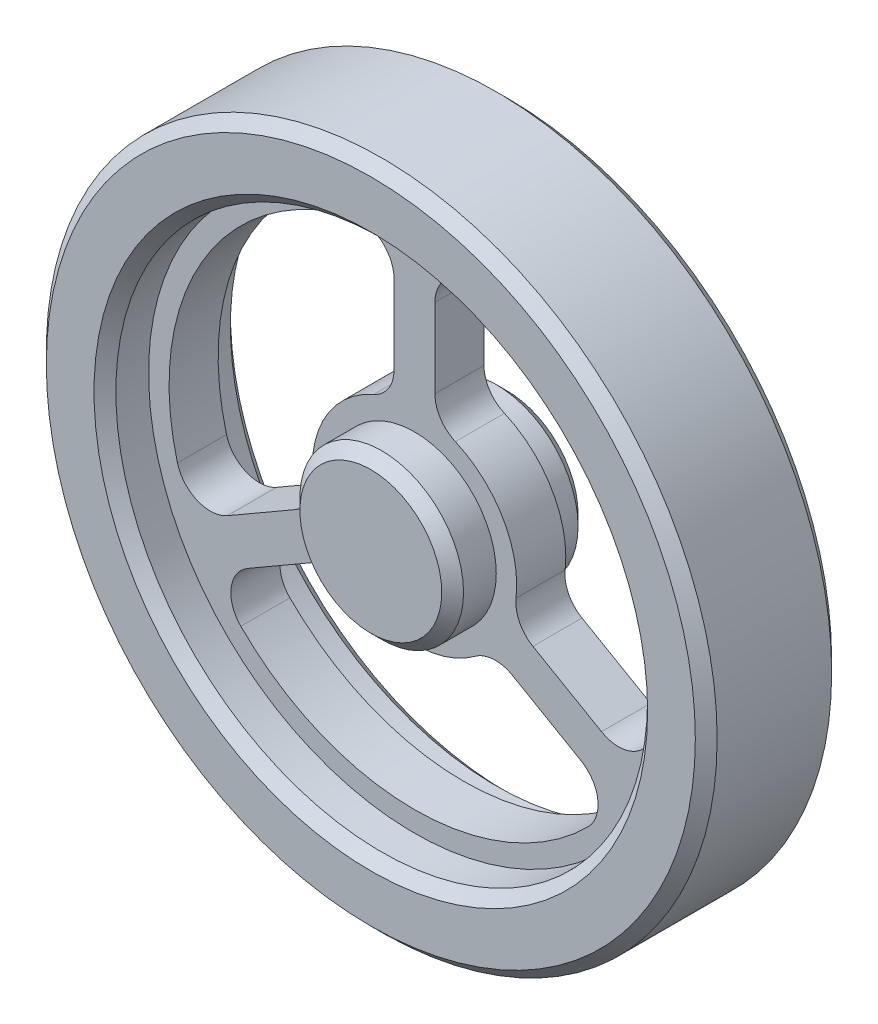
SolidWorks part; units mm, degrees
ref_plane "Front Plane" through (0, 0, 0) normal (0, 0, 1) x (1, 0, 0)
ref_plane "Top Plane" through (0, 0, 0) normal (0, 1, 0) x (1, 0, 0)
ref_plane "Right Plane" through (0, 0, 0) normal (1, 0, 0) x (0, 0, -1)
sketch "Sketch1" plane through (0, 0, 0) normal (0, 0, 1) x (1, 0, 0)
  circle A0 centre (0, 0) radius 24.6
  dimension "D1" = 49.2
extrude "Boss-Extrude1" add sketch "Sketch1" along normal mid plane 10
sketch "Sketch2" plane through (0, 0, 5) normal (0, 0, 1) x (1, 0, 0)
  circle A0 centre (0, 0) radius 6
  circle A1 centre (0, 0) radius 19.5
  dimension "D1" = 12
  dimension "D2" = 39
extrude "Cut-Extrude1" cut sketch "Sketch2" against normal blind 3.2 contours A1 | A0
mirror "Mirror1" about plane through (0, 0, 0) normal (0, 0, 1) of "Cut-Extrude1"
sketch "Sketch5" plane through (0, 0, 5) normal (0, 0, 1) x (1, 0, 0)
  circle A0 centre (0, 0) radius 7.5
  circle A1 centre (0, 0) radius 18
  dimension "D1" = 15
  dimension "D2" = 36
extrude "Cut-Extrude4" cut sketch "Sketch5" against normal through all
sketch "Sketch6" plane through (0, 0, 1.8) normal (0, 0, 1) x (1, 0, 0)
  line L0 (-1.5, 7.3485) -> (-1.5, 17.9374)
  line L1 (1.5, 17.9374) -> (1.5, 7.3485)
  line L2 (0, 0) -> (0, 33.4498) construction
  circle A0 centre (0, 0) radius 7.5 construction
  circle A1 centre (0, 0) radius 18 construction
  arc A2 (1.5, 7.3485) -> (-1.5, 7.3485) centre (0, 0) ccw
  arc A3 (1.5, 17.9374) -> (-1.5, 17.9374) centre (0, 0) ccw
  dimension "D1" = 3
  dimension "D2" = 1.5
extrude "Boss-Extrude2" add sketch "Sketch6" against normal up to surface (3.6 mm away)
fillet "Fillet1" radius 2.5 4 edges at (1.5, 7.3485, 0) (-1.5, 7.3485, 0) (-1.5, 17.9374, 0) (1.5, 17.9374, 0)
pattern_circular "CirPattern3" count 3 over 360 about axis through (0, 0, 0) along (0, 0, 1) of "Fillet1", "Boss-Extrude2"
sketch "Sketch9" plane through (0, 0, -5) normal (0, 0, -1) x (-1, 0, 0)
  circle A0 centre (0, 0) radius 3
  dimension "D1" = 6
extrude "Boss-Extrude3" add sketch "Sketch9" along normal blind 0.2
chamfer "Chamfer1" distance 0.8 angle 45 6 edges at (6, 0, -5) (6, 0, 5) (24.6, 0, -5) (19.5, 0, -5) (19.5, 0, 5) (24.6, 0, 5)
hole_wizard "M3x0.5 Tapped Hole1" positions "Sketch11" profile "Sketch10" tap size "M3x0.5" standard "ANSI Metric"
sketch "Sketch11" plane through (0, 0, -5.2) normal (0, 0, -1) x (-1, 0, 0)
  point P0 (0, 0)
sketch "Sketch10" plane through (0, 0, -5.2) normal (1, 0, 0) x (0, 1, 0)
  line L0 (0, 0) -> (0, 6.9511)
  line L1 (0, 6.9511) -> (1.25, 6.2)
  line L2 (1.25, 6.2) -> (1.25, 0)
  line L5 (1.25, 0) -> (0, 0)
  line L10 (0, 6.9511) -> (-1.25, 6.2) construction
  line L11 (0, -6.35) -> (0, 107.95) construction
  dimension "Tap Drill Dia." = 2.5
  dimension "Tap Drill Depth" = 6.2
  dimension "Drill Angle" = 118
